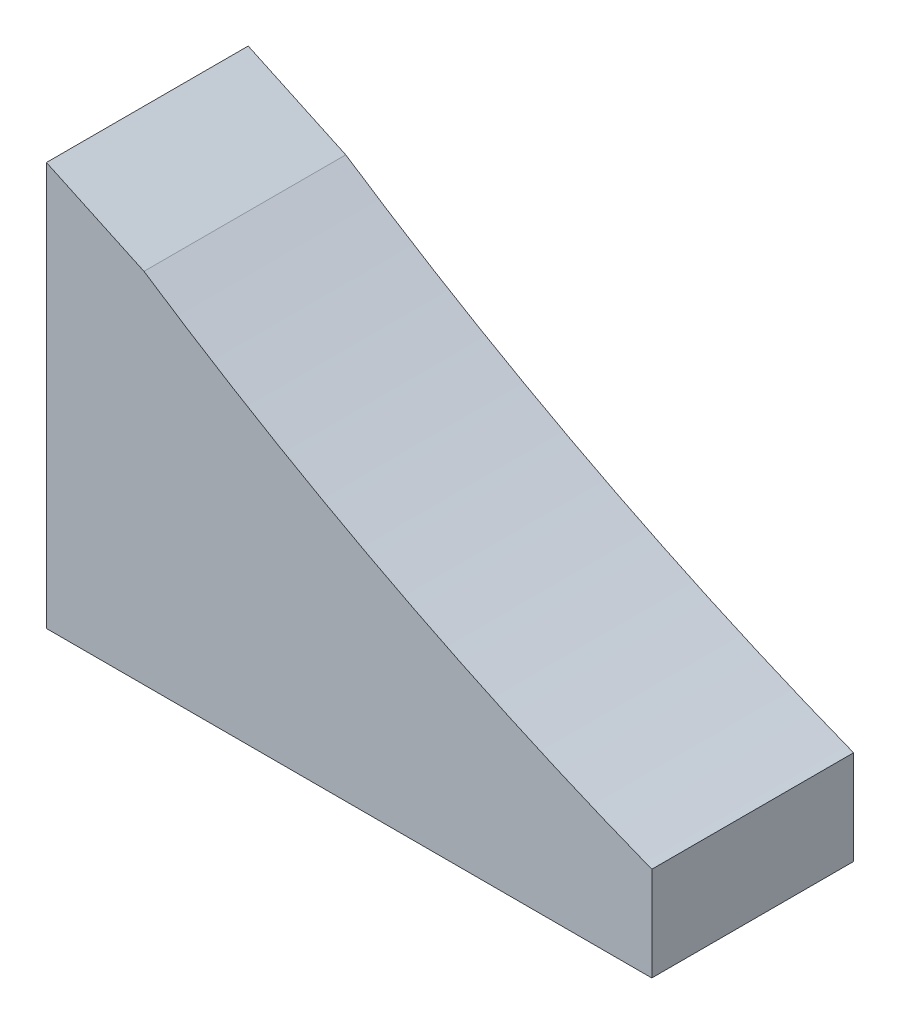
SolidWorks part; units mm, degrees
ref_plane "Front Plane" through (0, 0, 0) normal (0, 0, 1) x (1, 0, 0)
ref_plane "Top Plane" through (0, 0, 0) normal (0, 1, 0) x (1, 0, 0)
ref_plane "Right Plane" through (0, 0, 0) normal (1, 0, 0) x (0, 0, -1)
sketch "Sketch1" plane through (0, 0, 0) normal (0, 1, 0) x (1, 0, 0)
  line L1 (-14.2875, 4.7625) -> (14.2875, 4.7625)
  line L2 (-14.2875, 4.7625) -> (-14.2875, -4.7625)
  line L3 (-14.2875, -4.7625) -> (14.2875, -4.7625)
  line L4 (14.2875, 4.7625) -> (14.2875, -4.7625)
  dimension "D1" = 9.525
  dimension "D2" = 28.575
  dimension "D3" = 4.7625
  dimension "D4" = 14.2875
extrude "Boss-Extrude1" add sketch "Sketch1" along normal blind 19.05
sketch "Sketch3" plane through (0, 0, 4.7625) normal (0, 0, 1) x (1, 0, 0)
  line L0 (-14.2875, 19.05) -> (-9.6835, 16.9031)
  line L1 (-14.2875, 19.05) -> (14.2875, 19.05)
  line L2 (14.2875, 19.05) -> (14.2875, 4.445)
  line L3 (14.2875, 19.05) -> (14.2875, 0) construction
  arc A0 (-9.6835, 16.9031) -> (14.2875, 4.445) centre (60.5365, 122.7245) ccw
  dimension "D3" = 254
  dimension "D1" = 4.445
  dimension "D2" = 5.08
  dimension "D4" = 25
extrude "Cut-Extrude1" cut sketch "Sketch3" against normal through all
sketch "Sketch4" plane through (0, 0, 0) normal (0, -1, 0) x (1, 0, 0)
  circle A0 centre (-9.525, 0) radius 1.905
  circle A1 centre (9.525, 0) radius 1.905
  dimension "D1" = 3.81
  dimension "D2" = 3.81
  dimension "D3" = 9.525
  dimension "D4" = 19.05
extrude "Cut-Extrude2" cut sketch "Sketch4" against normal blind 5.08
